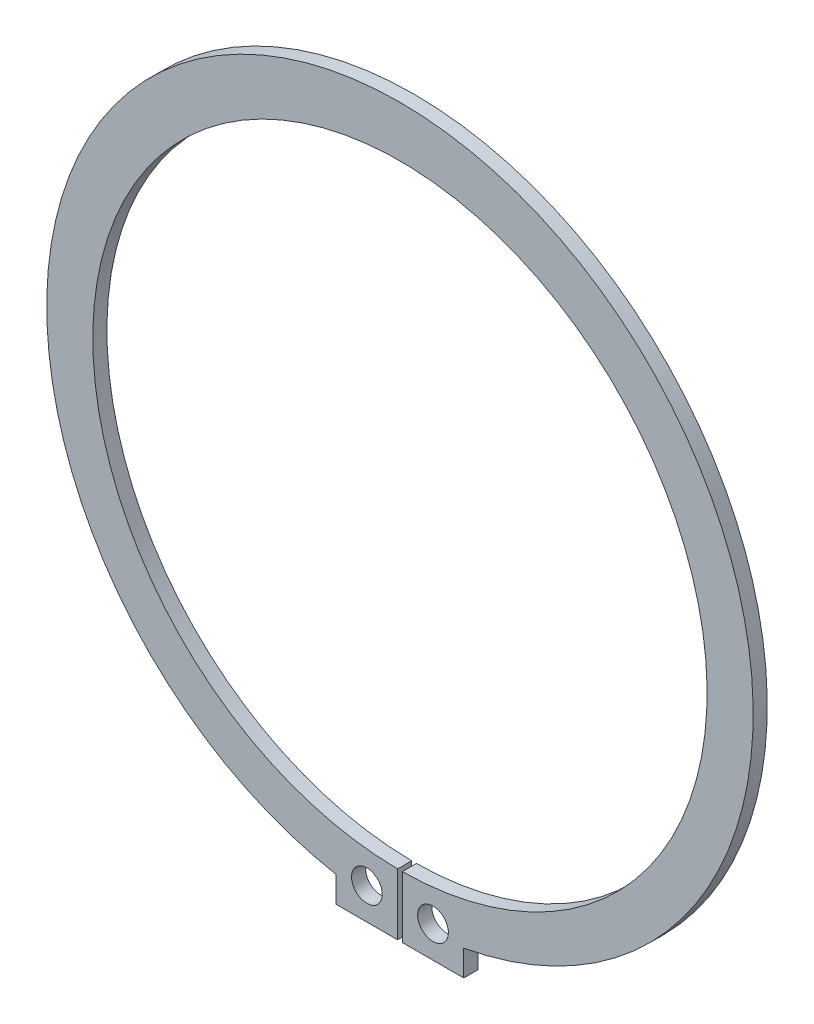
SolidWorks part; units mm, degrees
ref_plane "Plane1" through (0, 0, 0) normal (0, 0, 1) x (1, 0, 0)
ref_plane "Plane2" through (0, 0, 0) normal (0, 1, 0) x (1, 0, 0)
ref_plane "Plane3" through (0, 0, 0) normal (1, 0, 0) x (0, 0, -1)
sketch "Esquisse1" plane through (0, 0, 0) normal (0, 0, 1) x (1, 0, 0)
  circle A0 centre (0, 0) radius 28.06
  dimension "D1" = 56.12
extrude "épaisseur" add sketch "Esquisse1" along normal blind 1.12
sketch "Esquisse2" plane through (0, 0, 1.12) normal (0, 0, 1) x (1, 0, 0)
  circle A0 centre (0, -0.3733) radius 24.4
  dimension "D2" = 48.8
  dimension "D1" = 0.3733
extrude "diam int" cut sketch "Esquisse2" against normal through all
sketch "Esquisse3" plane through (0, 0, 1.12) normal (0, 0, 1) x (1, 0, 0)
  line L0 (0, 0) -> (0, -55.7798) construction
  line L1 (-0.1867, -24.7726) -> (-0.1867, -28.0594)
  line L2 (0.1867, -24.7726) -> (0.1867, -28.0594)
  circle A0 centre (0, 0) radius 28.06 construction
  circle A1 centre (0, -0.3733) radius 24.4 construction
  arc A2 (-0.1867, -28.0594) -> (0.1867, -28.0594) centre (0, 0) ccw
  arc A3 (-0.1867, -24.7726) -> (0.1867, -24.7726) centre (0, -0.3733) ccw
  dimension "D1" = 0.3733
extrude "fente" cut sketch "Esquisse3" against normal through all
sketch "Esquisse4" plane through (0, 0, 1.12) normal (0, 0, 1) x (1, 0, 0)
  line L0 (0, 0) -> (0, -64.5466) construction
  line L1 (0.1867, -24.7726) -> (0.1867, -29.6526)
  line L2 (0.1867, -29.6526) -> (5.0667, -29.6526)
  line L3 (5.0667, -29.6526) -> (5.0667, -24.2415)
  line L4 (-5.0667, -29.6526) -> (-5.0667, -24.2415)
  line L5 (-0.1867, -29.6526) -> (-5.0667, -29.6526)
  line L6 (-0.1867, -24.7726) -> (-0.1867, -29.6526)
  arc A0 (0.1867, -24.7726) -> (-0.1867, -24.7726) centre (0, -0.3733) ccw construction
  arc A1 (0.1867, -28.0594) -> (-0.1867, -28.0594) centre (0, 0) ccw construction
  arc A2 (0.1867, -24.7726) -> (5.0667, -24.2415) centre (0, -0.3733) ccw
  arc A3 (-0.1867, -24.7726) -> (-5.0667, -24.2415) centre (0, -0.3733) cw
  dimension "D1" = 4.88
  dimension "D2" = 4.88
extrude "Boss" add sketch "Esquisse4" against normal blind 1.12
sketch "Esquisse5" plane through (0, 0, 1.12) normal (0, 0, 1) x (1, 0, 0)
  line L0 (-2.6267, -29.6526) -> (-2.6267, -24.6315) construction
  line L1 (-0.1867, -29.6526) -> (-5.0667, -29.6526) construction
  line L2 (-0.1867, -46.2975) -> (-5.0667, -46.2975) construction
  line L3 (-0.1867, -24.7726) -> (-0.1867, -29.6526) construction
  line L4 (-5.0667, -29.6526) -> (-5.0667, -27.5988) construction
  line L5 (0, -0.3733) -> (0, -57.5369) construction
  circle A0 centre (-2.6267, -27.1421) radius 1.22
  arc A3 (0.1867, -24.7726) -> (-0.1867, -24.7726) centre (0, -0.3733) ccw construction
  circle A5 centre (2.6267, -27.1421) radius 1.22
  dimension "D1" = 2.44
extrude "Enlèv. mat.-Extru.1" cut sketch "Esquisse5" against normal through all
fillet "Congé4" [suppressed] radius 1.1902
fillet "Congé5" [suppressed] radius 0.61
equation "\"D1@Esquisse3\"=\"D1@Esquisse2\""
equation "\"D1@Esquisse2\"=\"D1@épaisseur\"/3"
equation "\"D1@Esquisse1\"=\"D2@Esquisse2\"*1.15"
equation "\"D1@Boss\"=\"D1@épaisseur\""
equation "\"D1@Esquisse4\"=\"D2@Esquisse2\"/10"
equation "\"D2@Esquisse4\"=\"D1@Esquisse4\""
equation "\"D1@Esquisse5\"=\"D2@Esquisse2\"/20"
equation "\"D1@Congé4\"=\"D2@Esquisse2\"/41"
equation "\"D1@Congé5\"=\"D2@Esquisse2\"/80"
